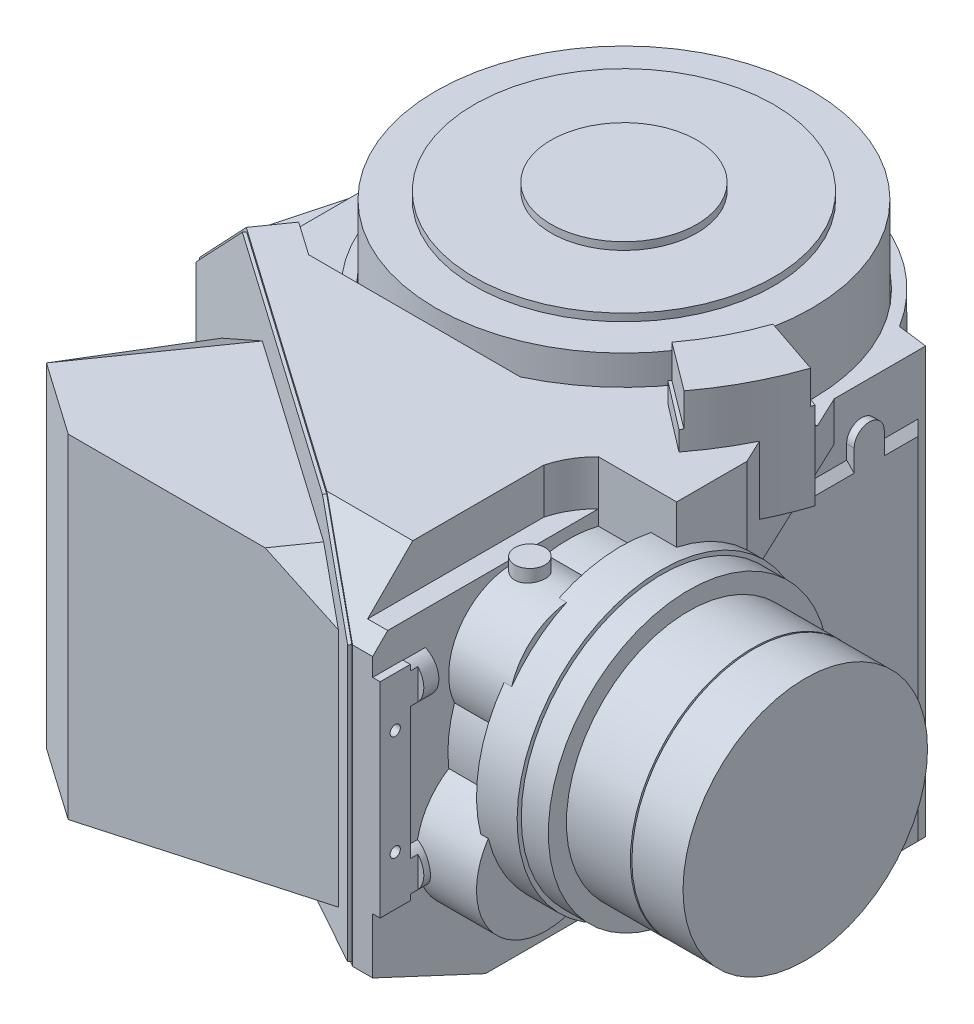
SolidWorks part; units mm, degrees
ref_plane "Front Plane" through (0, 0, 0) normal (0, 0, 1) x (1, 0, 0)
ref_plane "Top Plane" through (0, 0, 0) normal (0, 1, 0) x (1, 0, 0)
ref_plane "Right Plane" through (0, 0, 0) normal (1, 0, 0) x (0, 0, -1)
imported_body "Imported1"
sketch "Sketch13" plane through (440.5, 0, 0) normal (1, 0, 0) x (0, 0, -1)
  circle A0 centre (-1605, 0) radius 75
  dimension "D1" = 150
extrude "Extrude1" add sketch "Sketch13" against normal blind 50
hole_wizard "M8x1.25 Tapped Hole8" positions "Sketch17" profile "Sketch16" tap size "M8x1.25" standard "Ansi Metric"
sketch "Sketch17" plane through (0, -145, 0) normal (0, -1, 0) x (1, 0, 0)
  line L0 (283, 1605) -> (318, 1605) construction
  circle A0 centre (150, 1435) radius 125 construction
  point P0 (175, 1638)
  point P1 (255, 1638)
  point P3 (255, 1558)
  point P5 (175, 1558)
  dimension "D3" = 25
  dimension "D1" = 80
  dimension "D2" = 80
  dimension "D4" = 33
sketch "Sketch16" plane through (175, -145, 1638) normal (1, 0, 0) x (0, 0, -1)
  line L0 (0, 0) -> (0, 20.2929)
  line L1 (0, 20.2929) -> (3.4, 18.25)
  line L2 (3.4, 18.25) -> (3.4, 0)
  line L5 (3.4, 0) -> (0, 0)
  line L10 (0, 20.2929) -> (-3.4, 18.25) construction
  line L11 (0, -6.35) -> (0, 107.95) construction
  dimension "Tap Drill Dia." = 6.8
  dimension "Tap Drill Depth" = 18.25
  dimension "Drill Angle" = 118
hole_wizard "M8x1.25 Tapped Hole9" positions "Sketch19" profile "Sketch18" tap size "M8x1.25" standard "Ansi Metric"
sketch "Sketch19" plane through (288, 0, 0) normal (1, 0, 0) x (0, 0, -1)
  circle A0 centre (-1605, 0) radius 96 construction
  point P0 (-1725, 35)
  point P1 (-1725, -35)
  dimension "D1" = 120
  dimension "D2" = 35
  dimension "D3" = 70
sketch "Sketch18" plane through (288, 35, 1725) normal (0, 1, 0) x (0, 0, -1)
  line L0 (0, 0) -> (0, 20.2929)
  line L1 (0, 20.2929) -> (3.4, 18.25)
  line L2 (3.4, 18.25) -> (3.4, 0)
  line L5 (3.4, 0) -> (0, 0)
  line L10 (0, 20.2929) -> (-3.4, 18.25) construction
  line L11 (0, -6.35) -> (0, 107.95) construction
  dimension "Tap Drill Dia." = 6.8
  dimension "Tap Drill Depth" = 18.25
  dimension "Drill Angle" = 118
